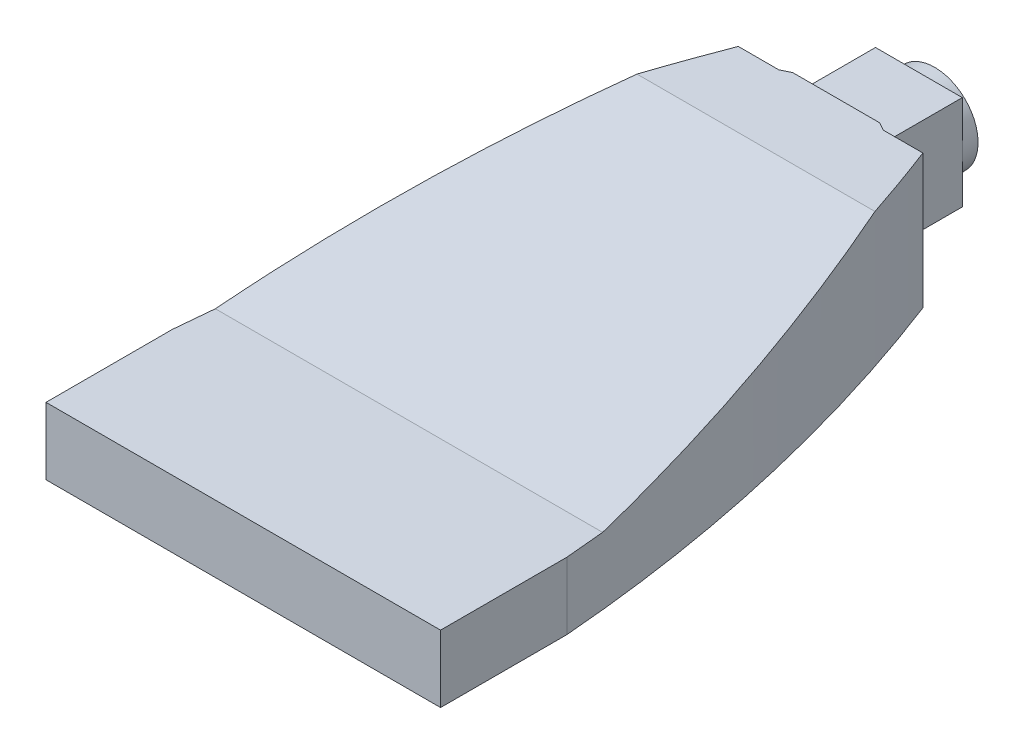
SolidWorks part; units mm, degrees
ref_plane "Front Plane" through (0, 0, 0) normal (0, 0, 1) x (1, 0, 0)
ref_plane "Top Plane" through (0, 0, 0) normal (0, 1, 0) x (1, 0, 0)
ref_plane "Right Plane" through (0, 0, 0) normal (1, 0, 0) x (0, 0, -1)
sketch "Schizzo1" plane through (0, 0, 0) normal (0, 1, 0) x (1, 0, 0)
  line L0 (-25.5, -23.9407) -> (24.5, -23.9407)
  line L1 (-0.5, -23.9407) -> (-0.5, 51.0593)
  line L2 (-0.5, 91.0608) -> (-0.5, -50.8296) construction
  line L3 (-5.8845, 51.0593) -> (5.1155, 51.0593)
  line L4 (5.1155, 51.0593) -> (5.1155, 61.5593)
  line L5 (5.1155, 61.5593) -> (-5.8845, 61.5593)
  line L6 (-5.8845, 61.5593) -> (-5.8845, 51.0593)
  line L7 (-25.5, -23.9407) -> (-25.5, -7.9407)
  line L8 (24.5, -23.9407) -> (24.5, -7.9407)
  line L9 (-12.1947, 50.4823) -> (11.1947, 50.4823)
  line L10 (-5.8845, 51.0593) -> (-7.0561, 50.4823)
  line L11 (5.1155, 51.0593) -> (6.1964, 50.4823)
  spline S0 degree 2 poles (-25.5, -7.9407) (-23.065, 22.2268) (-12.1947, 50.4823) knots 0 0 0 1 1 1
  spline S1 degree 2 poles (24.5, -7.9407) (22.065, 22.2268) (11.1947, 50.4823) knots 0 0 0 1 1 1
  dimension "D1" = 50
  dimension "D2" = 11
  dimension "D3" = 75
  dimension "D4" = 10.5
  dimension "D8" = 16
extrude "Estrusione-Estrusione1" add sketch "Schizzo1" along normal blind 17
sketch "Schizzo3" plane through (24.5, 0, 0) normal (1, 0, 0) x (0, 0, -1)
  line L0 (-23.9407, 8.5) -> (-7.9407, 8.5)
  line L1 (-23.9407, 17) -> (-23.9407, 0) construction
  line L2 (-7.9407, 17) -> (-7.9407, 0) construction
  line L3 (-7.9407, 8.5) -> (-2.9415, 8.5)
  line L4 (-2.9415, 8.5) -> (41.0271, 17)
  line L5 (50.4823, 17) -> (-7.9407, 17) construction
  line L6 (41.0271, 17) -> (50.4823, 17)
  line L7 (41.0271, 17) -> (-23.9407, 17)
  line L8 (-23.9407, 17) -> (-23.9407, 8.5)
extrude "Taglio-Estrusione2" cut sketch "Schizzo3" against normal blind 80 contours L4 L7 L3 M2 | L0 M4 M2 M3
mirror "Specchia1" about plane through (0, 17, 0) normal (0, 1, 0)
sketch "Schizzo7" plane through (0, 34, 0) normal (0, 1, 0) x (1, 0, 0)
  line L1 (-78.8617, 105.2619) -> (110.2688, 105.2619) construction
  line L2 (-78.8617, 105.2619) -> (-78.8617, -67.7065) construction
  line L3 (-78.8617, -67.7065) -> (110.2688, -67.7065) construction
  line L4 (110.2688, 105.2619) -> (110.2688, -67.7065) construction
extrude "Taglio-Estrusione3" cut sketch "Schizzo7" against normal blind 17
sketch "Schizzo9" plane through (-5.8845, 0, 0) normal (-1, 0, 0) x (0, 0, 1)
  line L1 (-51.0593, 17) -> (-51.0593, 0) construction
  line L2 (-61.5593, 0) -> (-51.0593, 0)
  line L3 (-61.5593, 0) -> (-61.5593, 2.5)
  line L4 (-61.5593, 2.5) -> (-51.0593, 2.5)
  line L5 (-51.0593, 0) -> (-51.0593, 2.5)
  line L7 (-61.5593, 17) -> (-51.0593, 17)
  line L8 (-61.5593, 17) -> (-61.5593, 14.5)
  line L9 (-61.5593, 14.5) -> (-51.0593, 14.5)
  line L10 (-51.0593, 17) -> (-51.0593, 14.5)
  dimension "D1" = 12
  dimension "D2" = 2.5
extrude "Taglio-Estrusione4" cut sketch "Schizzo9" against normal blind 11
sketch "Schizzo11" plane through (0, 0, -61.5593) normal (0, 0, -1) x (-1, 0, 0)
  line L0 (0.3845, 15.7175) -> (0.3845, 1.4359) construction
  line L1 (-6.1964, 8.5) -> (7.4002, 8.5) construction
  line L2 (-6.1964, 17) -> (-6.1964, 0) construction
  line L3 (-5.1155, 14.5) -> (-5.1155, 2.5) construction
  line L5 (-5.1155, 2.5) -> (5.8845, 2.5) construction
  circle A0 centre (0.3845, 8.5767) radius 5.5
  dimension "D3" = 11
  dimension "D1" = 5.5
  dimension "D2" = 6
extrude "Estrusione-Estrusione2" add sketch "Schizzo11" along normal blind 2
